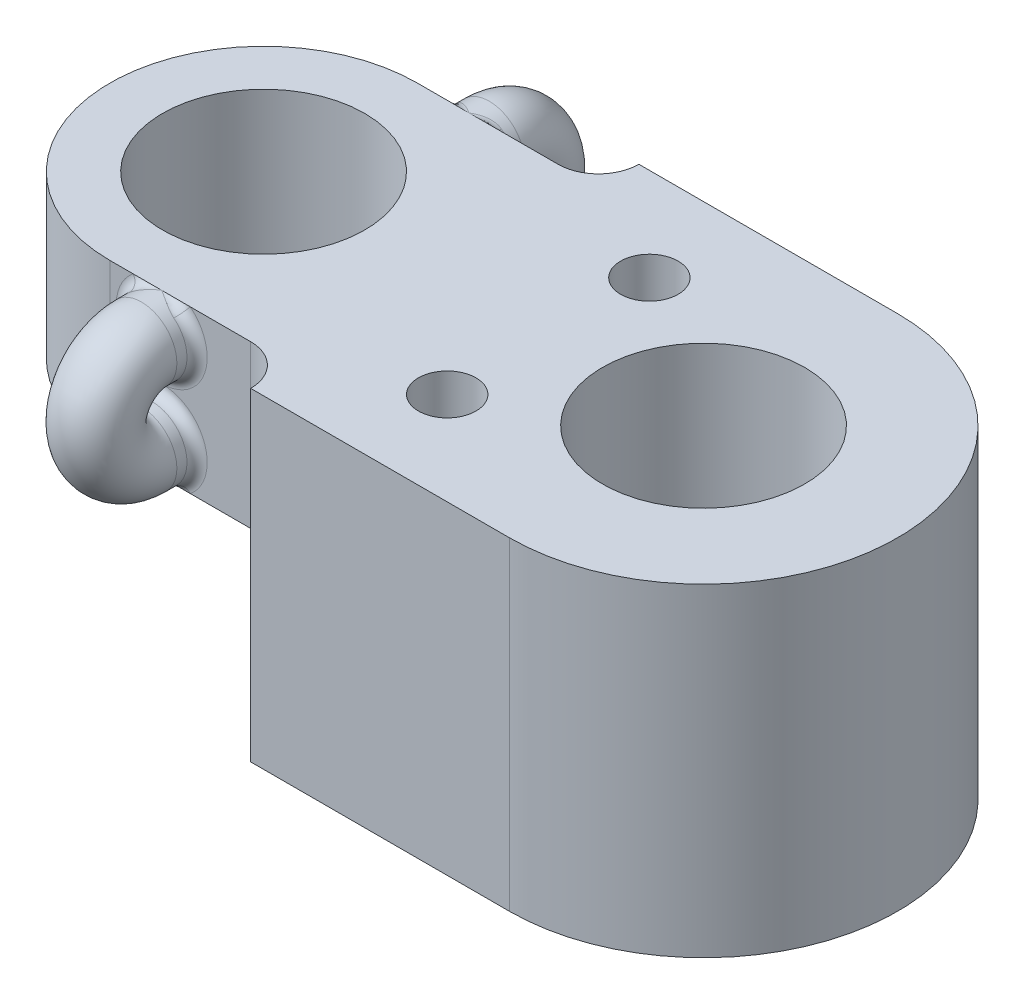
SolidWorks part; units mm, degrees
ref_plane "Front Plane" through (0, 0, 0) normal (0, 0, 1) x (1, 0, 0)
ref_plane "Top Plane" through (0, 0, 0) normal (0, 1, 0) x (1, 0, 0)
ref_plane "Right Plane" through (0, 0, 0) normal (1, 0, 0) x (0, 0, -1)
sketch "Sketch1" plane through (0, 0, 0) normal (0, 1, 0) x (1, 0, 0)
  line L1 (-8.636, 7.62) -> (8.636, 7.62)
  line L2 (-8.636, 7.62) -> (-8.636, -7.62)
  line L3 (-8.636, -7.62) -> (8.636, -7.62)
  line L4 (8.636, 7.62) -> (8.636, -7.62)
  line L5 (-8.636, 7.62) -> (8.636, -7.62) construction
  line L6 (-8.636, -7.62) -> (8.636, 7.62) construction
  arc A0 (-8.636, 7.62) -> (-8.636, -7.62) centre (-8.636, 0) ccw
  arc A1 (8.636, 7.62) -> (8.636, -7.62) centre (8.636, 0) cw
  point P0 (0, 0)
  dimension "D1" = 17.272
  dimension "D2" = 15.24
extrude "Boss-Extrude1" add sketch "Sketch1" along normal blind 12.7 contours L2 A0 | L4 L1 L2 L3 | A1 L4
sketch "Sketch2" plane through (0, 0, 0) normal (0, -1, 0) x (1, 0, 0)
  circle A0 centre (8.636, 0) radius 3.9688
  arc A3 (8.636, -7.62) -> (8.636, 7.62) centre (8.636, 0) ccw construction
  dimension "D1" = 7.9375
extrude "Cut-Extrude1" cut sketch "Sketch2" against normal through all contours A0
sketch "Sketch3" plane through (0, 0, 0) normal (0, -1, 0) x (1, 0, 0)
  line L0 (-1.524, 7.62) -> (-1.524, -7.62)
  line L1 (-8.636, 7.62) -> (8.636, 7.62) construction
  line L2 (-8.636, -7.62) -> (8.636, -7.62) construction
  line L3 (-1.524, -7.62) -> (-8.636, -7.62)
  line L4 (-1.524, 7.62) -> (-8.636, 7.62)
  arc A0 (-8.636, 7.62) -> (-8.636, -7.62) centre (-8.636, 0) ccw
  dimension "D1" = 7.112
extrude "Cut-Extrude2" cut sketch "Sketch3" against normal blind 6.35
sketch "Sketch4" plane through (0, 6.35, 0) normal (0, -1, 0) x (1, 0, 0)
  circle A0 centre (-8.636, 0) radius 3.9688
  arc A1 (-8.636, 7.62) -> (-8.636, -7.62) centre (-8.636, 0) ccw construction
  dimension "D1" = 7.9375
extrude "Cut-Extrude3" cut sketch "Sketch4" against normal through all
sketch "Sketch5" plane through (0, 0, 0) normal (0, -1, 0) x (1, 0, 0)
  line L0 (2.54, 7.62) -> (2.54, -7.62) construction
  line L1 (-1.524, 7.62) -> (8.636, 7.62) construction
  line L2 (-1.524, -7.62) -> (8.636, -7.62) construction
  line L3 (0, 0) -> (4.6672, 0) construction
  line L4 (-1.524, -7.62) -> (-1.524, 7.62) construction
  circle A0 centre (8.636, 0) radius 3.9688 construction
  point P6 (2.54, 3.9687)
  point P7 (2.54, -3.9687)
  dimension "D1" = 3.9688
  dimension "D2" = 4.064
hole_wizard "#4-40 Tapped Hole1" positions "3DSketch2" profile "Sketch6" tap size "#4-40" standard "ANSI Inch"
sketch3d "3DSketch2"
  point P0 (2.54, 0, 3.9687)
  point P3 (2.54, 0, -3.9687)
sketch "Sketch6" plane through (2.54, 0, 3.9687) normal (1, 0, 0) x (0, 0, -1)
  line L0 (0, 0) -> (0, 12.7)
  line L1 (0, 12.7) -> (1.1303, 12.7)
  line L2 (1.1303, 12.7) -> (1.1303, 0)
  line L5 (1.1303, 0) -> (0, 0)
  line L11 (0, -6.35) -> (0, 107.95) construction
  dimension "Thread Major Dia." = 2.2606
  dimension "Thru Tap Drill Depth" = 12.7
sketch "Sketch7" plane through (0, 6.35, 0) normal (0, -1, 0) x (1, 0, 0)
  line L0 (-1.524, -7.62) -> (-1.524, -6.0325)
  line L1 (-1.524, -7.62) -> (-1.524, 7.62) construction
  line L2 (-1.524, -6.0325) -> (-8.636, -6.0325)
  line L3 (-1.524, 6.0325) -> (-8.636, 6.0325)
  line L4 (-16.256, 0) -> (-1.524, 0) construction
  line L5 (-8.636, -7.62) -> (-1.524, -7.62) construction
  line L6 (-1.524, -7.62) -> (-8.636, -7.62)
  line L7 (-1.524, 6.0325) -> (-1.524, 7.62)
  line L8 (-1.524, 7.62) -> (-8.636, 7.62)
  arc A0 (-8.636, 6.0325) -> (-8.636, -6.0325) centre (-8.636, 0) ccw
  arc A1 (-8.636, 7.62) -> (-8.636, -7.62) centre (-8.636, 0) ccw construction
  arc A2 (-8.636, 7.62) -> (-8.636, -7.62) centre (-8.636, 0) ccw
  dimension "D1" = 1.5875
extrude "Cut-Extrude4" cut sketch "Sketch7" against normal through all
ref_plane "Plane1" through (-6.604, 0, 0) normal (-1, 0, 0) x (0, 0, 1)
ref_plane "Plane2" through (0, 0, 0) normal (0, 0, 1) x (1, 0, 0)
ref_plane "Plane3" through (0, 9.525, 0) normal (0, -1, 0) x (-1, 0, 0)
sketch "Sketch8" plane through (-6.604, 0, 0) normal (-1, 0, 0) x (0, 0, 1)
  line L0 (6.0325, 11.3109) -> (6.8262, 11.3109)
  line L1 (6.0325, 12.7) -> (6.0325, 6.35) construction
  line L2 (6.0325, 12.7) -> (-6.0325, 12.7) construction
  line L3 (6.8262, 11.3109) -> (6.8262, 7.7391) construction
  line L4 (6.8262, 7.7391) -> (6.0325, 7.7391)
  arc A0 (6.8262, 11.3109) -> (6.8262, 7.7391) centre (6.8262, 9.525) cw
  dimension "D1" = 1.7859
  dimension "D2" = 0.7937
  dimension "D3" = 1.3891
sketch "Sketch9" plane through (0, 0, 6.0325) normal (0, 0, 1) x (1, 0, 0)
  circle A0 centre (-6.604, 11.3109) radius 1.3891
  dimension "D1" = 2.7781
sweep "Sweep1" add profiles "Sketch9" path "Sketch8"
sketch "Sketch10" plane through (0, 9.525, 0) normal (0, -1, 0) x (-1, 0, 0)
  line L3 (1.524, 0) -> (14.6685, 0) construction
  line L4 (1.524, 6.0325) -> (1.524, -6.0325) construction
  circle A0 centre (6.604, -8.6122) radius 1.1906
  arc A1 (8.636, -6.0325) -> (8.636, 6.0325) centre (8.636, 0) ccw construction
  circle A2 centre (6.604, 8.6122) radius 1.1906
  dimension "D1" = 2.3813
mirror "Mirror1" about plane through (0, 0, 0) normal (0, 0, 1) of "Sweep1"
fillet "Fillet3" radius 0.3969 4 edges at (-5.2149, 11.3109, -6.0325) (-5.2149, 7.7391, -6.0325) (-5.2149, 7.7391, 6.0325) (-5.2149, 11.3109, 6.0325)
fillet "Fillet4" radius 1.5875 3 edges at (-1.524, 9.525, -6.0325) (-1.524, 6.35, 0) (-1.524, 9.525, 6.0325)
